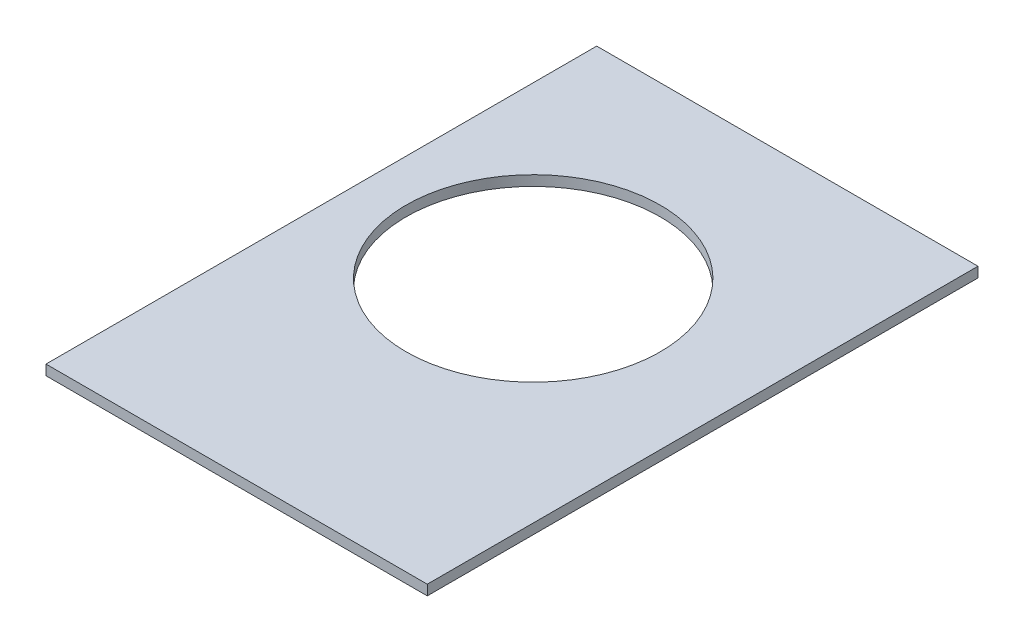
SolidWorks part; units mm, degrees
ref_plane "Front Plane" through (0, 0, 0) normal (0, 0, 1) x (1, 0, 0)
ref_plane "Top Plane" through (0, 0, 0) normal (0, 1, 0) x (1, 0, 0)
ref_plane "Right Plane" through (0, 0, 0) normal (1, 0, 0) x (0, 0, -1)
sketch "Sketch1" plane through (0, 0, 0) normal (0, 1, 0) x (1, 0, 0)
  line L1 (0, 0) -> (57.15, 0)
  line L2 (0, 0) -> (0, 82.55)
  line L3 (0, 82.55) -> (57.15, 82.55)
  line L4 (57.15, 0) -> (57.15, 82.55)
  dimension "D1" = 82.55
  dimension "D2" = 57.15
extrude "Boss-Extrude1" add sketch "Sketch1" along normal blind 1.524
sketch "Sketch2" plane through (0, 1.524, 0) normal (0, 1, 0) x (1, 0, 0)
  line L0 (57.15, 0) -> (57.15, 82.55) construction
  line L1 (0, 0) -> (57.15, 0) construction
  circle A0 centre (25.4, 47.625) radius 19.05
  dimension "D1" = 31.75
  dimension "D2" = 47.625
extrude "Cut-Extrude1" cut sketch "Sketch2" against normal through all both and the other way through all
